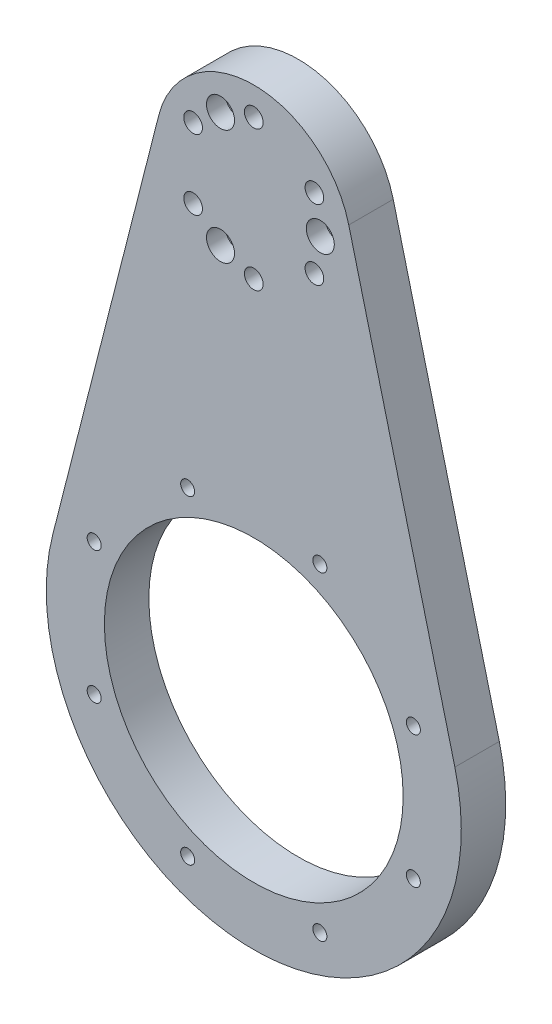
SolidWorks part; units mm, degrees
ref_plane "Front Plane" through (0, 0, 0) normal (1, 0, 0) x (0, 1, 0)
ref_plane "Top Plane" through (0, 0, 0) normal (0, 0, 1) x (0, 1, 0)
ref_plane "Right Plane" through (0, 0, 0) normal (0, 1, 0) x (-1, 0, 0)
sketch "Sketch1" plane through (0, 0, 0) normal (0, 0, 1) x (0, 1, 0)
  line L0 (-84.0279, 43.0745) -> (5.1837, 20.3502)
  line L1 (-84.0279, -43.0745) -> (5.1837, -20.3502)
  line L2 (-129.1835, 14.1593) -> (-95, 0) construction
  line L3 (0, 0) -> (15, 0) construction
  line L4 (12.3409, 7.125) -> (0, 0) construction
  line L5 (-95, 0) -> (-127, 0) construction
  arc A0 (5.1837, -20.3502) -> (5.1837, 20.3502) centre (0, 0) ccw
  arc A1 (-84.0279, 43.0745) -> (-84.0279, -43.0745) centre (-95, 0) ccw
  circle A2 centre (-95, 0) radius 32
  circle A3 centre (-129.1835, 14.1593) radius 1.5
  circle A4 centre (-109.1593, 34.1835) radius 1.5
  circle A5 centre (-80.8407, 34.1835) radius 1.5
  circle A6 centre (-60.8165, 14.1593) radius 1.5
  circle A7 centre (-60.8165, -14.1593) radius 1.5
  circle A8 centre (-80.8407, -34.1835) radius 1.5
  circle A9 centre (-109.1593, -34.1835) radius 1.5
  circle A10 centre (-129.1835, -14.1593) radius 1.5
  circle A11 centre (15, 0) radius 2
  circle A12 centre (7.5, -12.9904) radius 2
  circle A13 centre (-7.5, -12.9904) radius 2
  circle A14 centre (-15, 0) radius 2
  circle A15 centre (-7.5, 12.9904) radius 2
  circle A16 centre (7.5, 12.9904) radius 2
  circle A17 centre (12.3409, 7.125) radius 3
  circle A18 centre (0, -14.25) radius 3
  circle A19 centre (-12.3409, 7.125) radius 3
  dimension "D1" = 42
  dimension "D2" = 88.9
  dimension "D4" = 64
  dimension "D5" = 3
  dimension "D8" = 4
  dimension "D11" = 6
  dimension "D3" = 95
  dimension "D6" = 37
  dimension "D9" = 15
  dimension "D12" = 14.25
  dimension "D13" = 30
  dimension "D15" = 22.5
  dimension "D7" = 8
  dimension "D10" = 6
  dimension "D14" = 3
extrude "Boss-Extrude1" add sketch "Sketch1" along normal blind 9.525
sketch "Sketch2" plane through (0, 0, 9.525) normal (0, 0, 1) x (1, 0, 0)
  circle A0 centre (-7.125, -12.3409) radius 3
  circle A1 centre (14.25, 0) radius 3
  circle A2 centre (-7.125, 12.3409) radius 3
  circle A3 centre (-7.125, 12.3409) radius 3 construction
extrude "Boss-Extrude2" add sketch "Sketch2" along normal blind 5.525 from surface at -9.525
sketch "Sketch3" plane through (0, 0, 9.525) normal (0, 0, 1) x (1, 0, 0)
  line L0 (0, -139.45) -> (0, -184.225) construction
  line L1 (-76.2, 65.775) -> (76.2, 65.775)
  line L2 (-76.2, 65.775) -> (-76.2, -184.225)
  line L3 (-76.2, -184.225) -> (76.2, -184.225)
  line L4 (76.2, 65.775) -> (76.2, -184.225)
  line L5 (-76.2, 65.775) -> (76.2, -184.225) construction
  line L6 (-76.2, -184.225) -> (76.2, 65.775) construction
  line L7 (0, 65.775) -> (0, 21) construction
  line L8 (69.85, 65.775) -> (69.85, -184.225) construction
  line L9 (57.15, -95) -> (69.85, -95) construction
  arc A0 (-43.0745, -84.0279) -> (43.0745, -84.0279) centre (0, -95) ccw construction
  arc A1 (20.3502, 5.1837) -> (-20.3502, 5.1837) centre (0, 0) ccw construction
  circle A2 centre (50.8, -95) radius 6.35
  point P0 (0, -59.225)
  point P17 (0, -95)
  point P23 (0, -56.4349)
  dimension "D3" = 12.7
  dimension "D1" = 152.4
  dimension "D2" = 250
  dimension "D4" = 6.35
